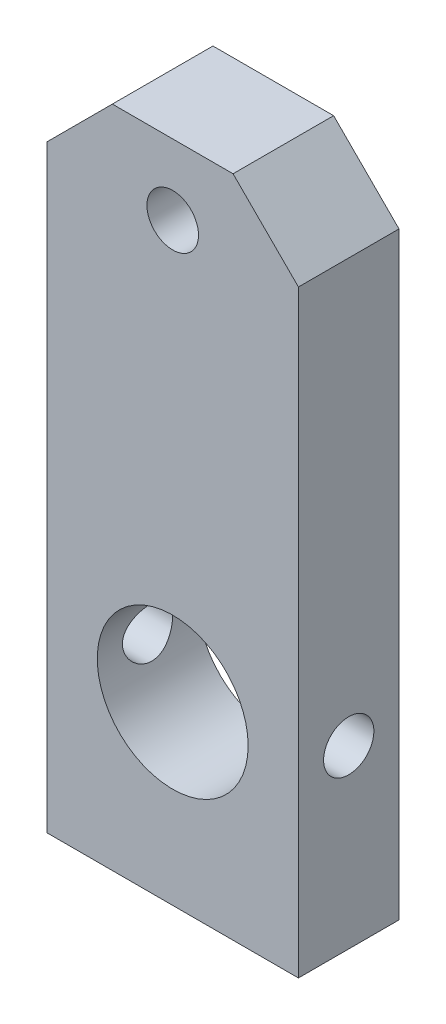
SolidWorks part; units mm, degrees
ref_plane "Face" through (0, 0, 0) normal (0, 0, 1) x (1, 0, 0)
ref_plane "Dessus" through (0, 0, 0) normal (0, 1, 0) x (1, 0, 0)
ref_plane "Droite" through (0, 0, 0) normal (1, 0, 0) x (0, 0, -1)
sketch "Esquisse1" plane through (0, 0, 0) normal (0, 0, 1) x (1, 0, 0)
  line L0 (12, 132) -> (25, 119)
  line L1 (-12, 132) -> (12, 132)
  line L2 (-25, 119) -> (-25, 0)
  line L3 (-25, 0) -> (25, 0)
  line L4 (25, 119) -> (25, 0)
  line L5 (-25, 119) -> (-12, 132)
  circle A0 centre (0, 35) radius 15
  circle A1 centre (0, 118) radius 5.125
  point P0 (-25, 132)
  point P3 (25, 132)
  point P4 (0, 0)
  dimension "D5" = 30
  dimension "D7" = 10.25
  dimension "D3" = 13
  dimension "D4" = 13
  dimension "D1" = 132
  dimension "D2" = 50
  dimension "D6" = 35
  dimension "D8" = 14
extrude "Base-Extrusion" add sketch "Esquisse1" along normal mid plane 20
sketch "Esquisse2" plane through (25, 0, 0) normal (1, 0, 0) x (0, 0, -1)
  circle A0 centre (0, 35) radius 5
  dimension "D2" = 10
  dimension "D1" = 35
extrude "Enlèv. mat.-Extru.1" cut sketch "Esquisse2" against normal through all
